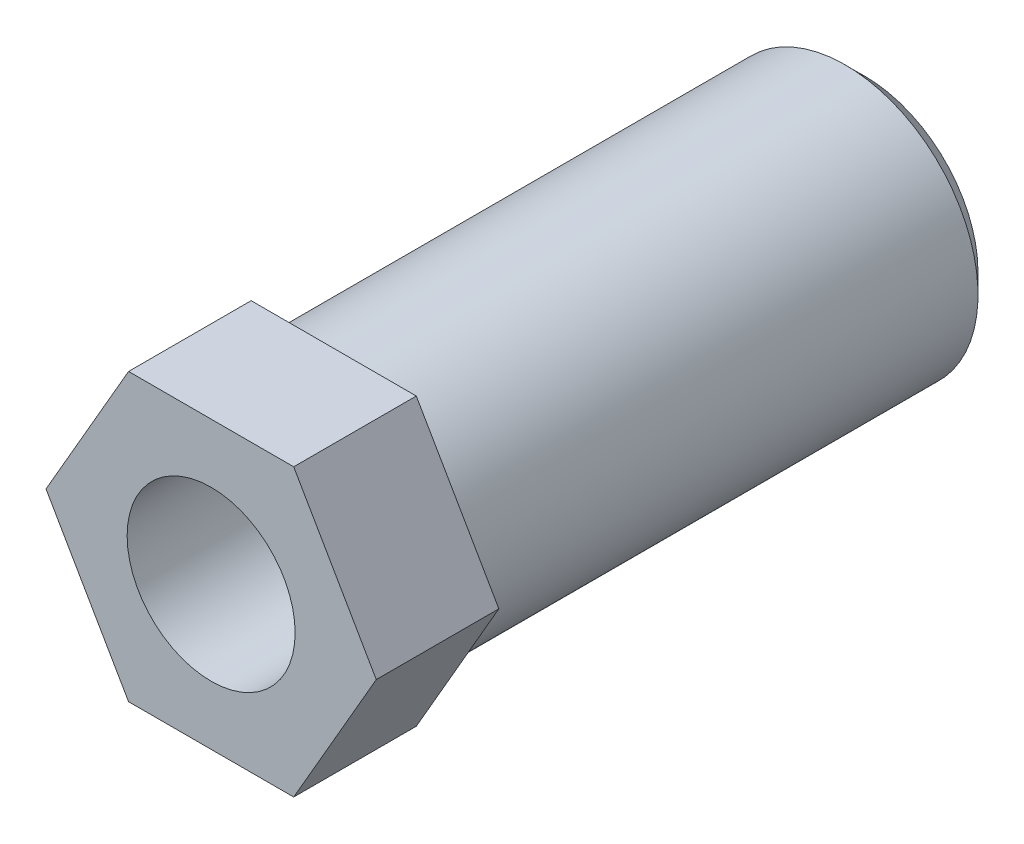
SolidWorks part; units mm, degrees
ref_plane "FRONT" through (0, 0, 0) normal (0, 0, 1) x (1, 0, 0)
ref_plane "TOP" through (0, 0, 0) normal (0, 1, 0) x (1, 0, 0)
ref_plane "SIDE" through (0, 0, 0) normal (1, 0, 0) x (0, 0, -1)
sketch "Sketch1" plane through (0, 0, 0) normal (0, 0, 1) x (1, 0, 0)
  line L1 (6.4158, 0) -> (3.2079, 5.5562)
  line L2 (3.2079, 5.5562) -> (-3.2079, 5.5562)
  line L3 (-3.2079, 5.5562) -> (-6.4158, 0)
  line L4 (-6.4158, 0) -> (-3.2079, -5.5562)
  line L5 (-3.2079, -5.5562) -> (3.2079, -5.5563)
  line L6 (3.2079, -5.5563) -> (6.4158, 0)
  circle A0 centre (0, 0) radius 5.5563 construction
  dimension "D1" = 11.1125
extrude "Base-Extrude" add sketch "Sketch1" along normal blind 25.4
hole_wizard "5/16-18 Tapped Hole1" positions "Sketch3" profile "Sketch2"
sketch "Sketch3" plane through (0, 0, 0) normal (0, 0, -1) x (-1, 0, 0)
  point P0 (0, 0)
sketch "Sketch2" plane through (0, 0, 0) normal (1, 0, 0) x (0, 1, 0)
  line L0 (0, 0) -> (0, 25.4)
  line L1 (0, 25.4) -> (3.2639, 25.4)
  line L2 (3.2639, 25.4) -> (3.2639, 0)
  line L5 (3.2639, 0) -> (0, 0)
  line L11 (0, -6.35) -> (0, 107.95) construction
  dimension "Thru Hole Dia." = 6.5278
  dimension "Thru Hole Depth" = 25.4
chamfer "Chamfer2" distance 0.762 angle 45
sketch "Sketch4" plane through (0, 0, 0) normal (0, 0, -1) x (-1, 0, 0)
  circle A0 centre (0, 0) radius 5.1562
  circle A1 centre (0, 0) radius 7.5313
  dimension "D1" = 10.3124
  dimension "D2" = 15.0627
extrude "Cut-Extrude1" cut sketch "Sketch4" against normal blind 20.6375
chamfer "Chamfer1" distance 0.762 angle 45
